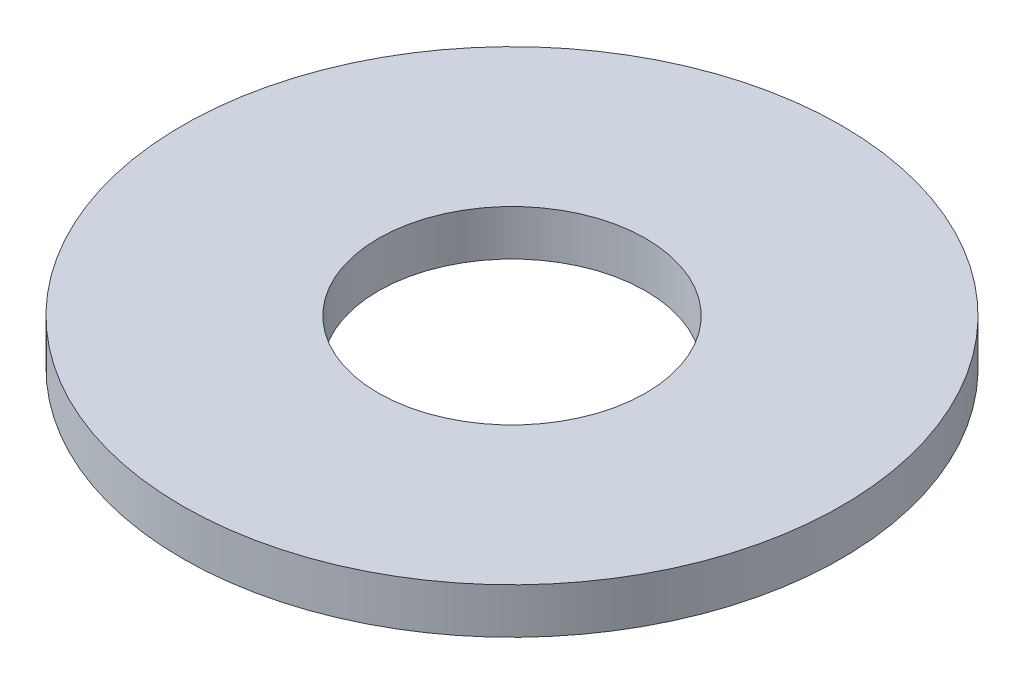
SolidWorks part; units mm, degrees
ref_plane "Front Plane" through (0, 0, 0) normal (0, 0, 1) x (1, 0, 0)
ref_plane "Top Plane" through (0, 0, 0) normal (0, 1, 0) x (1, 0, 0)
ref_plane "Right Plane" through (0, 0, 0) normal (1, 0, 0) x (0, 0, -1)
sketch "Sketch1" plane through (0, 0, 0) normal (0, 1, 0) x (1, 0, 0)
  circle A0 centre (0, 0) radius 12.7
  circle A1 centre (0, 0) radius 5.1562
  dimension "D1" = 10.3124
  dimension "D2" = 25.4
extrude "Extrude1" add sketch "Sketch1" along normal blind 1.7526
